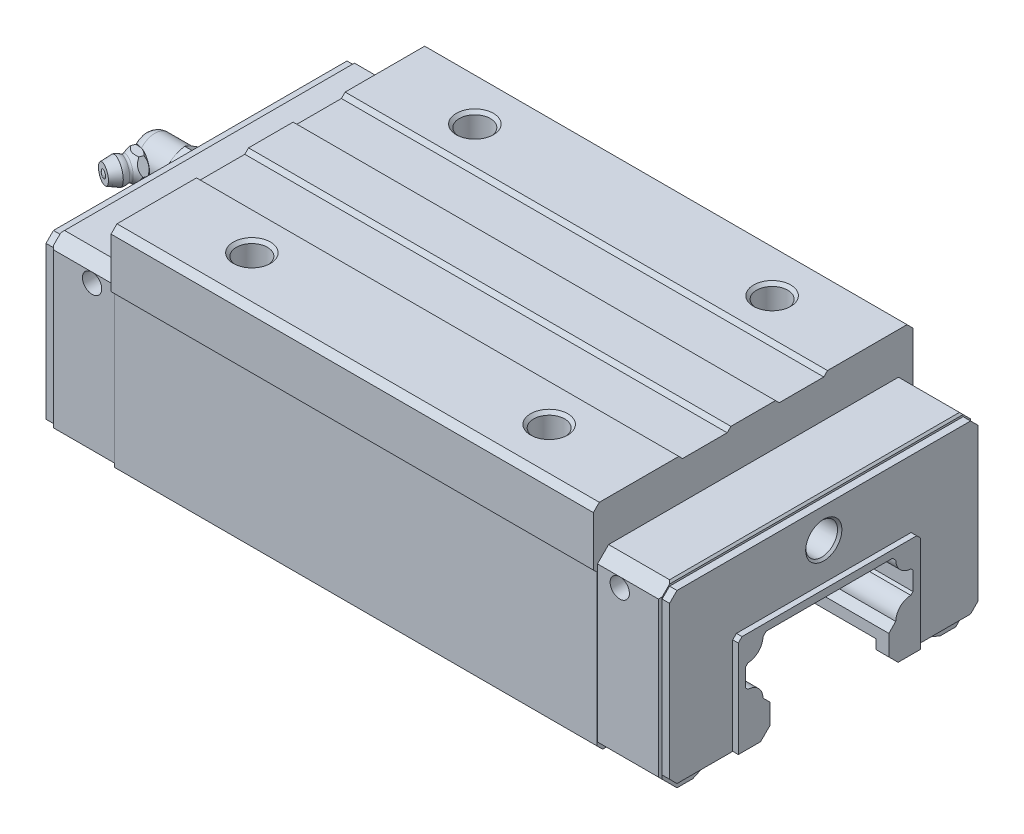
SolidWorks part; units mm, degrees
ref_plane "Front Plane" through (0, 0, 0) normal (0, 0, 1) x (1, 0, 0)
ref_plane "Top Plane" through (0, 0, 0) normal (0, 1, 0) x (1, 0, 0)
ref_plane "Right Plane" through (0, 0, 0) normal (1, 0, 0) x (0, 0, -1)
imported_body "HSR45LR1SS-570L_G22-5_0_B-PT18_199-6_0_0_0_1(R2).stp-1/_HSR45LRSSB-PT1_81 Slider-1-R2.stp-1-solid1"
imported_body "HSR45LR1SS-570L_G22-5_0_B-PT18_199-6_0_0_0_1(R2).stp-1/_hsr_ftht_B-PT1_8_grease_nipple_joint.stp-1-solid1"
move or copy body "Body-Move/Copy1" bodies to move or copy 104 103 copy no translate (-262.5, 0, 0)
